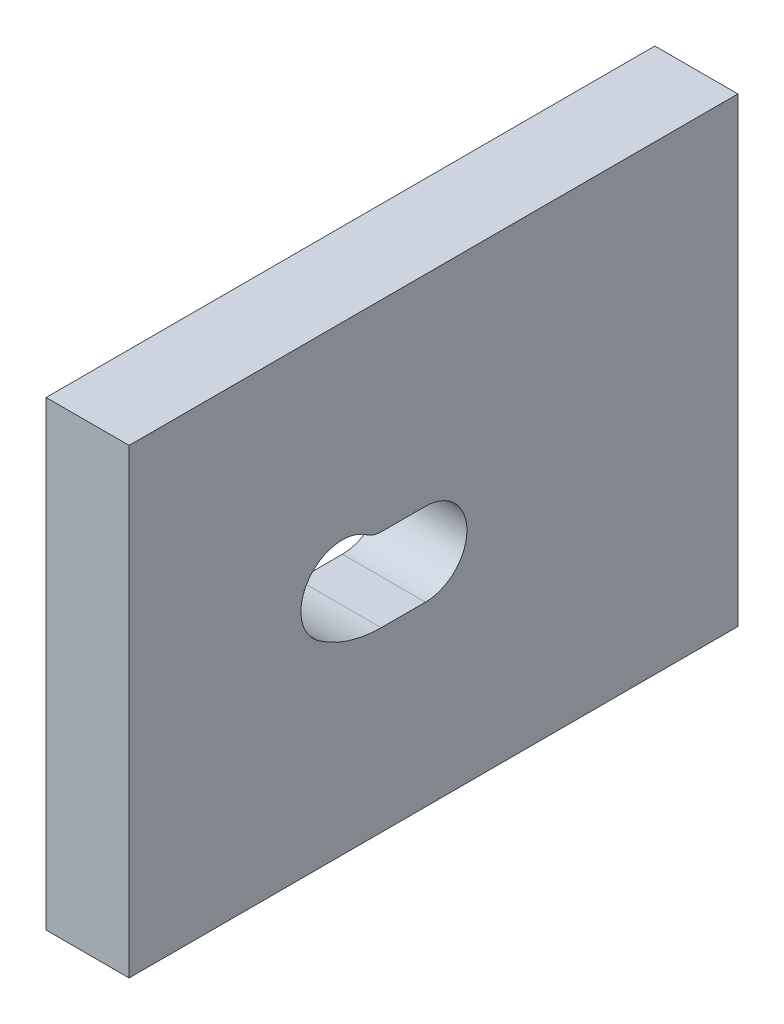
SolidWorks part; units mm, degrees
ref_plane "Front Plane" through (0, 0, 0) normal (0, 0, 1) x (1, 0, 0)
ref_plane "Top Plane" through (0, 0, 0) normal (0, 1, 0) x (1, 0, 0)
ref_plane "Right Plane" through (0, 0, 0) normal (1, 0, 0) x (0, 0, -1)
sketch "Sketch1" plane through (0, 0, 0) normal (1, 0, 0) x (0, 0, -1)
  line L0 (10.6726, 0) -> (0, 0) construction
  line L1 (10.6726, 10) -> (0, 10)
  line L2 (10.6726, -10) -> (0, -10)
  line L4 (-60.7218, 58.4004) -> (85.9508, 58.4004)
  line L5 (-60.7218, 58.4004) -> (-60.7218, -52.727)
  line L6 (-60.7218, -52.727) -> (85.9508, -52.727)
  line L7 (85.9508, 58.4004) -> (85.9508, -52.727)
  arc A0 (0, 0) -> (-9.3274, 3) centre (0, 16) cw construction
  arc A1 (0, 10) -> (-3.4978, 11.125) centre (0, 16) cw
  arc A2 (0, -10) -> (-15.157, -5.125) centre (0, 16) cw
  arc A3 (10.6726, 10) -> (10.6726, -10) centre (10.6726, 0) cw
  arc A4 (-3.4978, 11.125) -> (-15.157, -5.125) centre (-9.3274, 3) ccw
  dimension "D2" = 6
  dimension "D1" = 3
  dimension "D3" = 20
  dimension "D4" = 20
extrude "Extrude1" add sketch "Sketch1" along normal blind 20
